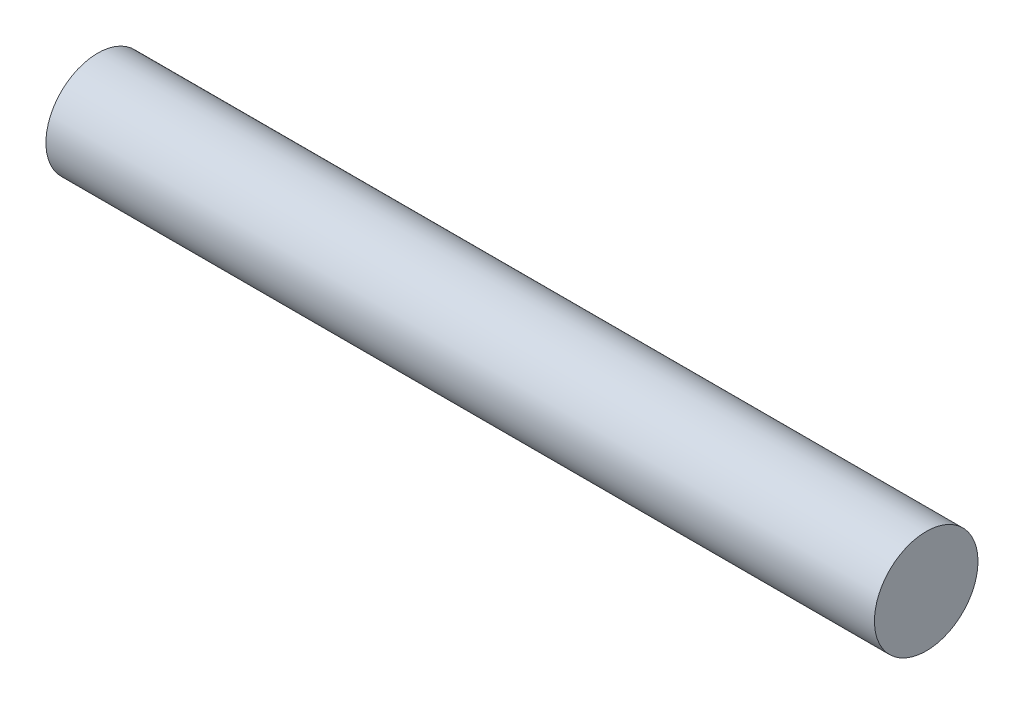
SolidWorks part; units mm, degrees
ref_plane "Alzado" through (0, 0, 0) normal (0, 0, 1) x (1, 0, 0)
ref_plane "Planta" through (0, 0, 0) normal (0, 1, 0) x (1, 0, 0)
ref_plane "Vista lateral" through (0, 0, 0) normal (1, 0, 0) x (0, 0, -1)
sketch "Croquis1" plane through (0, 0, 0) normal (1, 0, 0) x (0, 0, -1)
  circle A0 centre (0, 0) radius 7.5
  dimension "D1" = 15
extrude "Saliente-Extruir1" add sketch "Croquis1" along normal blind 120
